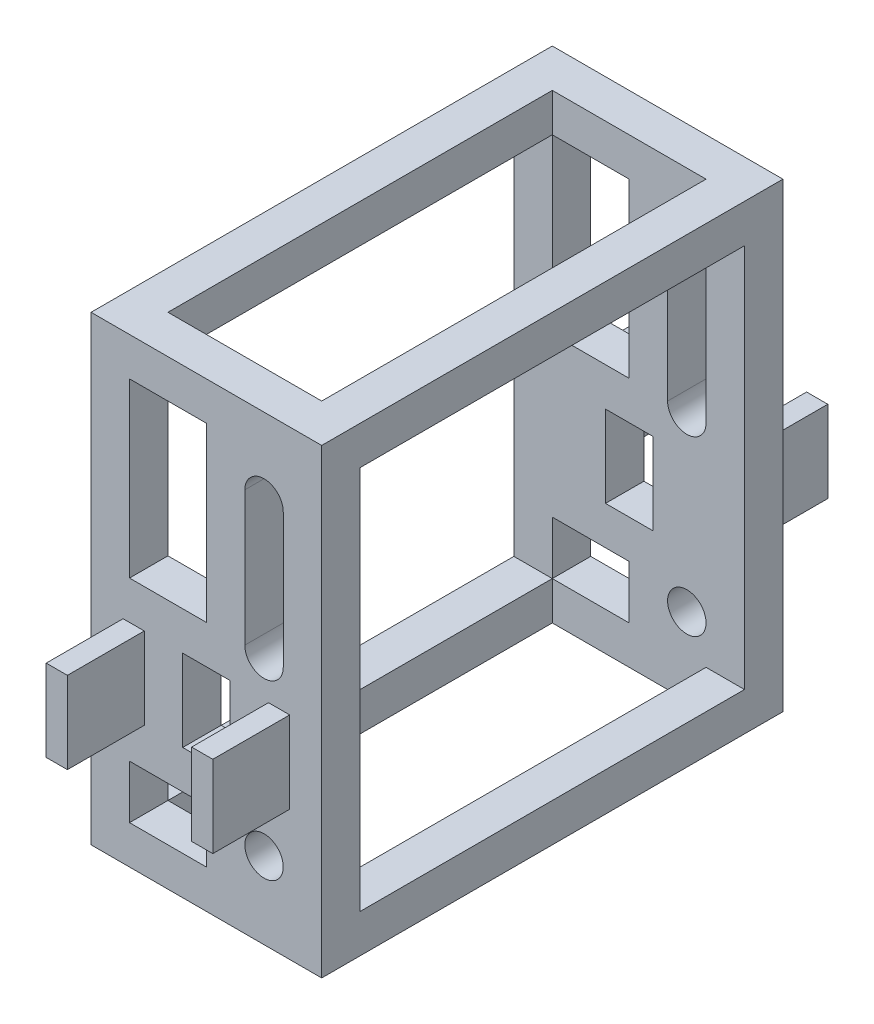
SolidWorks part; units mm, degrees
ref_plane "Front Plane" through (0, 0, 0) normal (0, 0, 1) x (1, 0, 0)
ref_plane "Top Plane" through (0, 0, 0) normal (0, 1, 0) x (1, 0, 0)
ref_plane "Right Plane" through (0, 0, 0) normal (1, 0, 0) x (0, 0, -1)
sketch "Sketch1" plane through (0, 0, 0) normal (0, 0, 1) x (1, 0, 0)
  line L1 (0, 0) -> (76.2, 0)
  line L2 (0, 0) -> (0, 152.4)
  line L3 (0, 152.4) -> (76.2, 152.4)
  line L4 (76.2, 0) -> (76.2, 152.4)
  dimension "D1" = 76.2
  dimension "D2" = 152.4
extrude "Boss-Extrude1" add sketch "Sketch1" along normal blind 152.4
sketch "Sketch2" plane through (0, 152.4, 0) normal (0, 1, 0) x (1, 0, 0)
  line L0 (76.2, 0) -> (0, 0) construction
  line L1 (12.7, -12.7) -> (63.5, -12.7)
  line L2 (12.7, -12.7) -> (12.7, -139.7)
  line L3 (12.7, -139.7) -> (63.5, -139.7)
  line L4 (63.5, -12.7) -> (63.5, -139.7)
  line L5 (76.2, -152.4) -> (76.2, 0) construction
  line L6 (0, -152.4) -> (0, 0) construction
  line L7 (76.2, -152.4) -> (0, -152.4) construction
  dimension "D1" = 12.7
  dimension "D2" = 12.7
  dimension "D3" = 12.7
  dimension "D4" = 12.7
extrude "Cut-Extrude1" cut sketch "Sketch2" against normal through all
sketch "Sketch4" plane through (76.2, 0, 0) normal (1, 0, 0) x (0, 0, -1)
  line L0 (-152.4, 152.4) -> (0, 152.4) construction
  line L1 (-139.7, 139.7) -> (-12.7, 139.7)
  line L2 (-139.7, 139.7) -> (-139.7, 12.7)
  line L3 (-139.7, 12.7) -> (-12.7, 12.7)
  line L4 (-12.7, 139.7) -> (-12.7, 12.7)
  line L5 (0, 0) -> (0, 152.4) construction
  line L6 (-152.4, 0) -> (-152.4, 152.4) construction
  line L7 (-152.4, 0) -> (0, 0) construction
  dimension "D1" = 12.7
  dimension "D2" = 12.7
  dimension "D3" = 12.7
  dimension "D4" = 12.7
extrude "Cut-Extrude3" cut sketch "Sketch4" against normal through all
sketch "Sketch5" plane through (0, 0, 152.4) normal (0, 0, 1) x (1, 0, 0)
  line L0 (0, 0) -> (76.2, 0) construction
  line L1 (10.575, 70) -> (17.575, 70)
  line L2 (10.575, 70) -> (10.575, 43)
  line L3 (10.575, 43) -> (17.575, 43)
  line L4 (17.575, 70) -> (17.575, 43)
  line L5 (58.625, 70) -> (65.625, 70)
  line L6 (58.625, 70) -> (58.625, 43)
  line L7 (58.625, 43) -> (65.625, 43)
  line L8 (65.625, 70) -> (65.625, 43)
  line L9 (0, 152.4) -> (0, 0) construction
  dimension "D1" = 27
  dimension "D2" = 70
  dimension "D3" = 7
  dimension "D4" = 41.05
  dimension "D5" = 10.575
extrude "Boss-Extrude2" add sketch "Sketch5" along normal blind 25.4
ref_plane "Plane1" through (0, 0, 76.2) normal (0, 0, 1) x (1, 0, 0)
mirror "Mirror1" about plane through (0, 0, 76.2) normal (0, 0, 1) of "Boss-Extrude2"
sketch "Sketch6" plane through (0, 0, 152.4) normal (0, 0, 1) x (1, 0, 0)
  line L0 (76.2, 0) -> (76.2, 152.4) construction
  line L1 (50.8, 127) -> (50.8, 82.55)
  line L2 (63.5, 127) -> (63.5, 82.55)
  line L3 (76.2, 152.4) -> (0, 152.4) construction
  line L4 (0, 0) -> (76.2, 0) construction
  arc A0 (63.5, 127) -> (50.8, 127) centre (57.15, 127) ccw
  arc A1 (50.8, 82.55) -> (63.5, 82.55) centre (57.15, 82.55) ccw
  circle A2 centre (57.15, 25.4) radius 6.35
  dimension "D1" = 12.7
  dimension "D2" = 19.05
  dimension "D3" = 44.45
  dimension "D4" = 25.4
  dimension "D5" = 25.4
extrude "Cut-Extrude4" cut sketch "Sketch6" against normal through all
sketch "Sketch7" plane through (0, 0, 152.4) normal (0, 0, 1) x (1, 0, 0)
  line L0 (0, 0) -> (76.2, 0) construction
  line L1 (12.7, 139.7) -> (38.1, 139.7)
  line L2 (12.7, 139.7) -> (12.7, 82.7)
  line L3 (12.7, 82.7) -> (38.1, 82.7)
  line L4 (38.1, 139.7) -> (38.1, 82.7)
  line L5 (12.7, 30.3) -> (38.1, 30.3)
  line L6 (12.7, 30.3) -> (12.7, 12.7)
  line L7 (12.7, 12.7) -> (38.1, 12.7)
  line L8 (38.1, 30.3) -> (38.1, 12.7)
  line L9 (0, 152.4) -> (0, 0) construction
  line L10 (10.575, 43) -> (17.575, 43) construction
  line L11 (17.575, 70) -> (10.575, 70) construction
  line L12 (50.8, 127) -> (50.8, 82.55) construction
  line L13 (76.2, 152.4) -> (0, 152.4) construction
  line L14 (17.575, 43) -> (17.575, 70) construction
  line L16 (30.275, 70) -> (30.275, 43)
  line L17 (30.275, 43) -> (45.925, 43)
  line L20 (30.275, 70) -> (45.925, 70)
  line L21 (17.575, 43) -> (17.575, 70) construction
  line L22 (45.925, 70) -> (45.925, 43)
  line L23 (58.625, 70) -> (58.625, 43) construction
  circle A0 centre (57.15, 25.4) radius 6.35 construction
  dimension "D1" = 12.7
  dimension "D2" = 12.7
  dimension "D3" = 19.05
  dimension "D4" = 12.7
  dimension "D5" = 12.7
  dimension "D6" = 12.7
  dimension "D7" = 12.7
  dimension "D8" = 12.7
  dimension "D9" = 12.7
  dimension "D10" = 12.7
extrude "Cut-Extrude5" cut sketch "Sketch7" against normal through all
